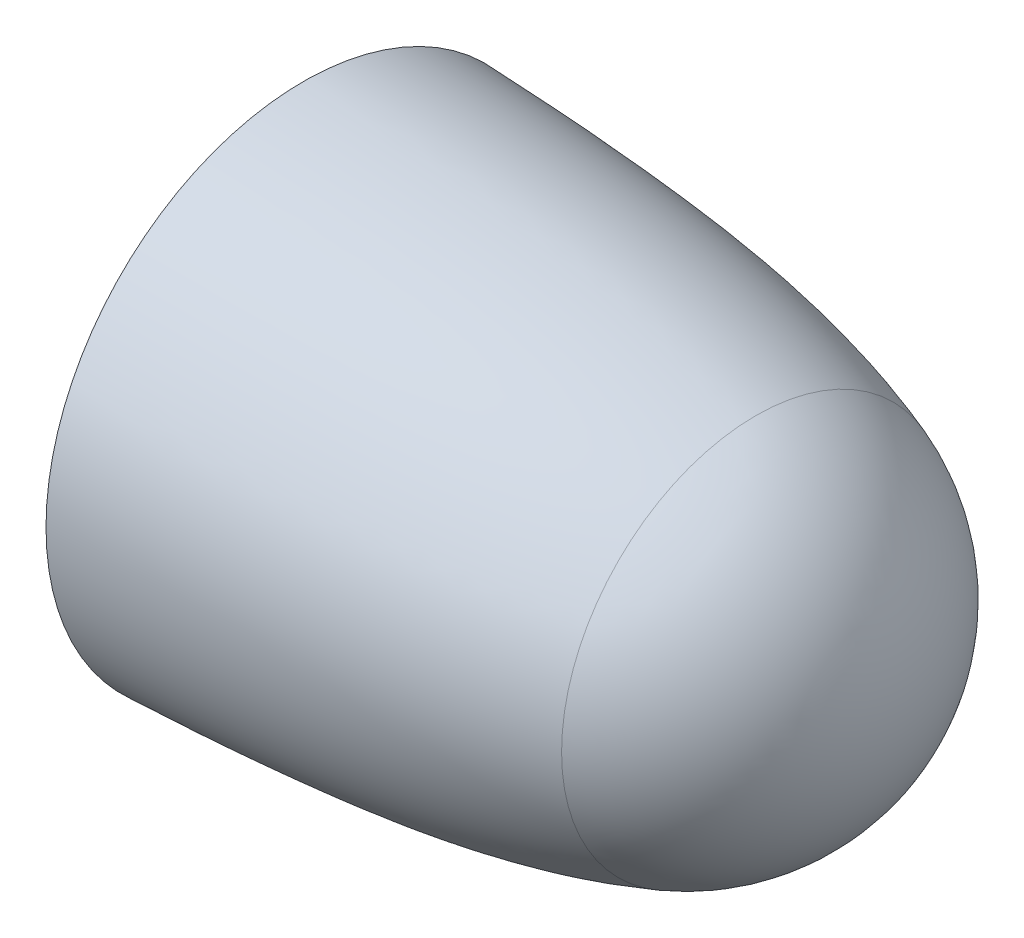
SolidWorks part; units mm, degrees
ref_plane "Front Plane" through (0, 0, 0) normal (0, 0, 1) x (1, 0, 0)
ref_plane "Top Plane" through (0, 0, 0) normal (0, 1, 0) x (1, 0, 0)
ref_plane "Right Plane" through (0, 0, 0) normal (1, 0, 0) x (0, 0, -1)
sketch "Sketch1" plane through (0, 0, 0) normal (0, 0, 1) x (1, 0, 0)
  line L0 (4343.4, 399.2705) -> (4343.4, 392.9163)
  line L1 (4343.3786, 0) -> (5497.8131, 0) construction
  line L2 (5251.45, 0) -> (5257.8, 0)
  arc A0 (5045.3781, -301.3798) -> (5045.3781, 301.3798) centre (4937.7933, 0) ccw construction
  arc A1 (5257.8, 0) -> (5045.3781, 301.3798) centre (4937.7933, 0) ccw
  arc A2 (5251.45, 0) -> (5043.2433, 295.3995) centre (4937.7933, 0) ccw
  spline S0 degree 3 poles (5993.2914, -1390.6345) (5727.6861, 193.2671) (4059.7568, 631.3055) (2220.9036, 166.1972) (1983.0086, 1193.5719) knots -0.926724 -0.926724 -0.926724 -0.926724 0.339771 2.846658 2.846658 2.846658 2.846658 only from (5045.3781, 301.3798) to (3686.81, 405.13) construction
  spline S1 degree 3 poles (5045.3781, 301.3798) (4898.1058, 353.9523) (4663.3255, 383.6419) (4425.3227, 396.3046) (4343.4, 399.2705) knots 0 0 0 0 0.339771 0.518108 0.518108 0.518108 0.518108
  spline S2 degree 1 poles (5043.2433, 295.3995) (4343.1703, 392.9247) knots 0 0 1 1 construction
  spline S3 degree 3 poles (5043.2433, 295.3995) (5036.2752, 297.8869) (5022.276, 302.724) (4994.1895, 311.8122) (4958.8504, 322.1416) (4916.1229, 333.0113) (4858.7523, 345.6497) (4786.3575, 358.2985) (4698.6102, 369.5046) (4610.2034, 377.777) (4521.3799, 384.2651) (4432.3402, 389.3311) (4372.894, 391.8485) (4343.1703, 392.9247) knots 0 0 0 0 0.016191 0.032382 0.064763 0.097145 0.129527 0.19429 0.259054 0.323817 0.388581 0.453344 0.518108 0.518108 0.518108 0.518108 only from (5043.2433, 295.3995) to (4343.4, 392.9163)
  dimension "D1" = 914.4
  dimension "D2" = 6.35
revolve "Revolve6" add sketch "Sketch1" angle 360 about L1
